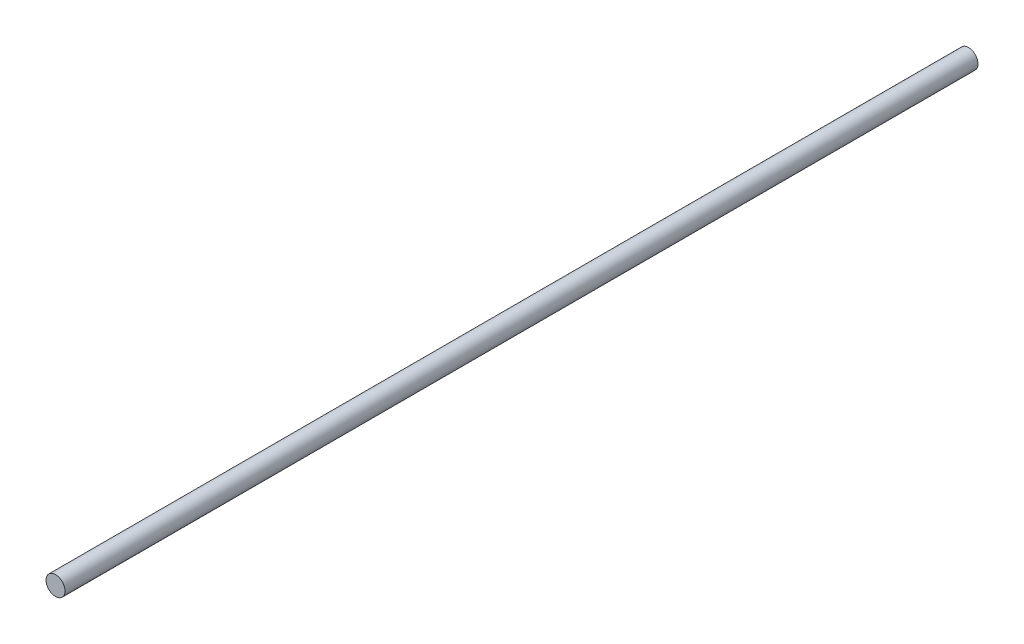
SolidWorks part; units mm, degrees
ref_plane "Front" through (0, 0, 0) normal (0, 0, 1) x (1, 0, 0)
ref_plane "Top" through (0, 0, 0) normal (0, 1, 0) x (1, 0, 0)
ref_plane "Right" through (0, 0, 0) normal (1, 0, 0) x (0, 0, -1)
sketch "Sketch1" plane through (0, 0, 0) normal (0, 0, 1) x (1, 0, 0)
  circle A0 centre (0, 0) radius 3.175
  dimension "D1" = 6.35
extrude "Extrude1" add sketch "Sketch1" along normal blind 304.8
